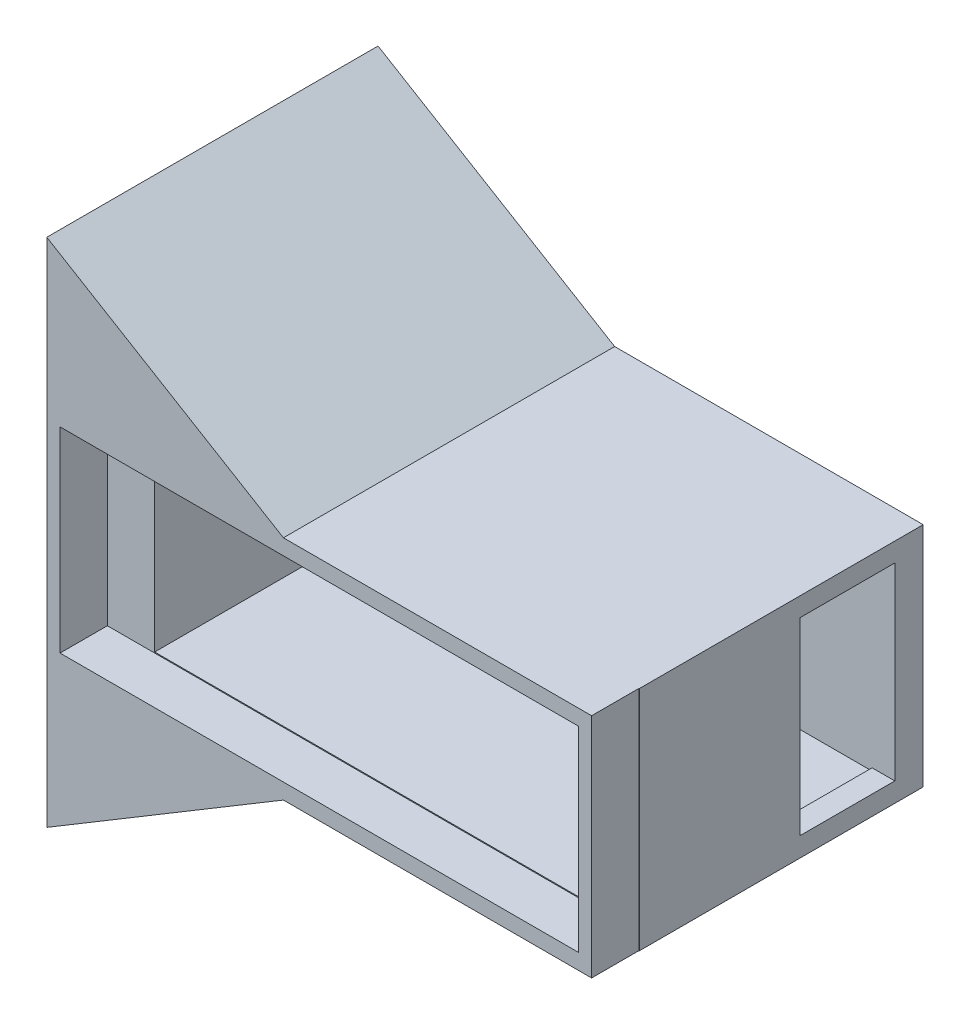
SolidWorks part; units mm, degrees
ref_plane "Front Plane" through (0, 0, 0) normal (0, 0, 1) x (1, 0, 0)
ref_plane "Top Plane" through (0, 0, 0) normal (0, 1, 0) x (1, 0, 0)
ref_plane "Right Plane" through (0, 0, 0) normal (1, 0, 0) x (0, 0, -1)
sketch "Sketch2" plane through (0, 0, 0) normal (0, 0, 1) x (1, 0, 0)
  line L1 (-28.8, 12) -> (28.8, 12)
  line L2 (-28.8, 12) -> (-28.8, -12)
  line L3 (-28.8, -12) -> (28.8, -12)
  line L4 (28.8, 12) -> (28.8, -12)
  line L5 (-28.8, 12) -> (28.8, -12) construction
  line L6 (-28.8, -12) -> (28.8, 12) construction
  point P0 (0, 0)
  dimension "D1" = 24
  dimension "D2" = 57.6
extrude "Boss-Extrude1" add sketch "Sketch2" along normal blind 30
sketch "Sketch5" plane through (0, 0, 30) normal (0, 0, 1) x (1, 0, 0)
  line L1 (-22.4, 10.25) -> (22.4, 10.25)
  line L2 (-22.4, 10.25) -> (-22.4, -10.25)
  line L3 (-22.4, -10.25) -> (22.4, -10.25)
  line L4 (22.4, 10.25) -> (22.4, -10.25)
  line L5 (-22.4, 10.25) -> (22.4, -10.25) construction
  line L6 (-22.4, -10.25) -> (22.4, 10.25) construction
  point P0 (0, 0)
  dimension "D1" = 20.5
  dimension "D2" = 44.8
extrude "Cut-Extrude1" cut sketch "Sketch5" against normal blind 27
sketch "Sketch10" plane through (0, 0, 30) normal (0, 0, 1) x (1, 0, 0)
  line L0 (-28.8, 12) -> (-28.8, -12)
  line L1 (-28.8, 12) -> (28.7632, 12)
  line L2 (-28.8, -12) -> (28.7632, -12)
  line L3 (28.7632, 12) -> (28.7632, -12)
extrude "Boss-Extrude2" add sketch "Sketch10" along normal blind 5
sketch "Sketch11" plane through (0, 0, 35) normal (0, 0, 1) x (1, 0, 0)
  line L1 (-27.4, 10.35) -> (27.4, 10.35)
  line L2 (-27.4, 10.35) -> (-27.4, -10.35)
  line L3 (-27.4, -10.35) -> (27.4, -10.35)
  line L4 (27.4, 10.35) -> (27.4, -10.35)
  line L5 (-27.4, 10.35) -> (27.4, -10.35) construction
  line L6 (-27.4, -10.35) -> (27.4, 10.35) construction
  point P0 (0, 0)
  dimension "D1" = 20.7
  dimension "D2" = 54.8
extrude "Cut-Extrude3" cut sketch "Sketch11" against normal blind 5
sketch "Sketch15" plane through (28.8, 0, 0) normal (1, 0, 0) x (0, 0, -1)
  line L0 (-3, -0.0029) -> (-3, -9.9482)
  line L1 (-3, -0.0029) -> (-3, 9.9971)
  line L2 (-3, 9.9971) -> (-13, 9.9971)
  line L3 (-3, -9.9482) -> (-13, -9.9482)
  line L4 (-13, -9.9482) -> (-13, 9.9971)
extrude "Cut-Extrude4" cut sketch "Sketch15" against normal up to surface (6.4 mm away)
sketch "Sketch16" plane through (0, 0, 30) normal (0, 0, 1) x (1, 0, 0)
  line L0 (22.4, -10.25) -> (26.4, -10.25)
  line L3 (22.4, 10.25) -> (22.4, -10.25)
  line L4 (26.4, 10.25) -> (26.4, -10.25)
  line L5 (26.4, 10.25) -> (22.4, 10.25)
extrude "Cut-Extrude5" cut sketch "Sketch16" against normal blind 27 contours L4 L0 L3 L5
sketch "Sketch17" plane through (0, 0, 0) normal (0, 0, 1) x (1, 0, 0)
  line L0 (-28.8, 12) -> (-28.8, 27)
  line L1 (-28.8, 27) -> (-3.8, 12)
  line L2 (28.7632, 12) -> (-28.8, 12) construction
  line L3 (-3.8, 12) -> (-28.8, 12)
  line L4 (-28.8, 0) -> (-15.6964, 0) construction
  line L5 (-28.8, 12) -> (-28.8, -12) construction
  line L10 (-28.8, -27) -> (-3.8, -12)
  line L11 (-28.8, -12) -> (-28.8, -27)
  line L12 (-3.8, -12) -> (-28.8, -12)
extrude "Boss-Extrude3" add sketch "Sketch17" along normal through all
